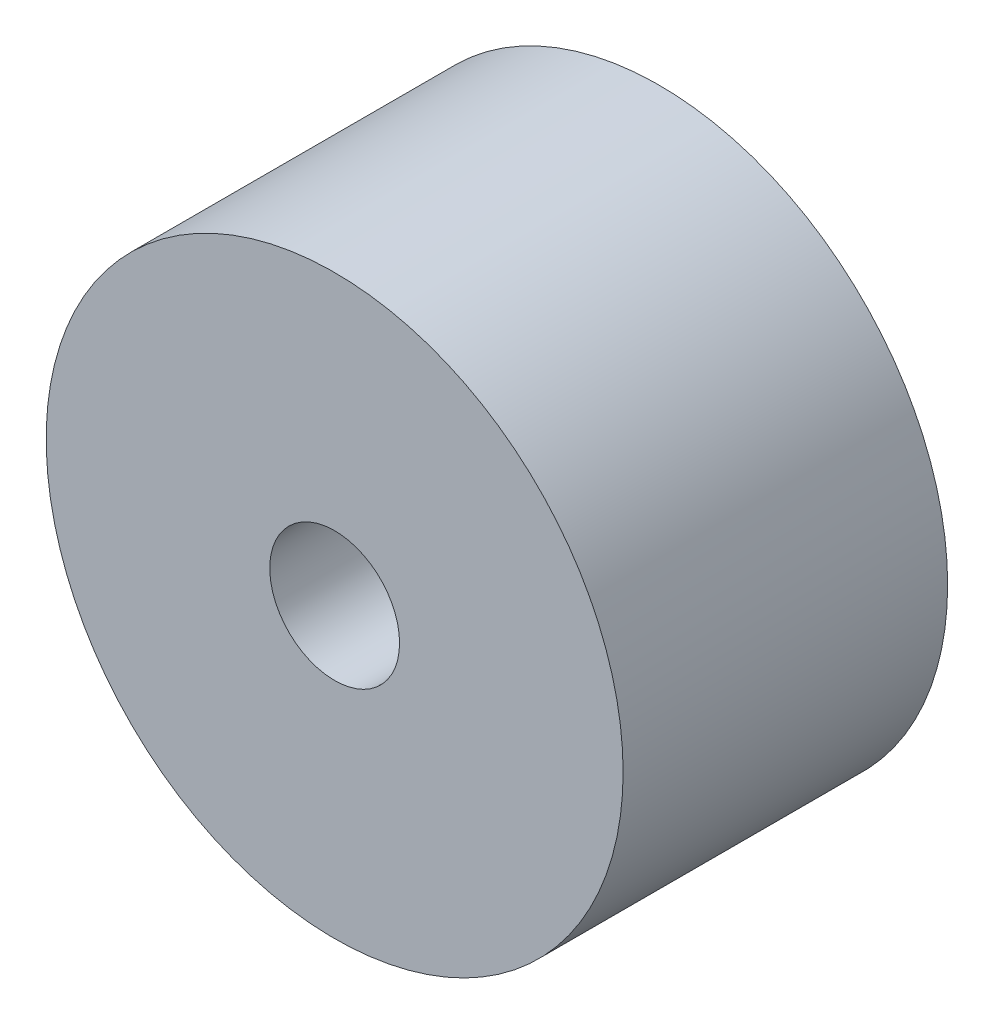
SolidWorks part; units mm, degrees
ref_plane "Front Plane" through (0, 0, 0) normal (0, 0, 1) x (1, 0, 0)
ref_plane "Top Plane" through (0, 0, 0) normal (0, 1, 0) x (1, 0, 0)
ref_plane "Right Plane" through (0, 0, 0) normal (1, 0, 0) x (0, 0, -1)
sketch "Sketch1" plane through (0, 0, 0) normal (0, 0, 1) x (1, 0, 0)
  circle A0 centre (0, 0) radius 4
  circle A1 centre (0, 0) radius 0.9
  dimension "D1" = 8
  dimension "D2" = 1.8
extrude "Boss-Extrude1" add sketch "Sketch1" along normal blind 4.5
